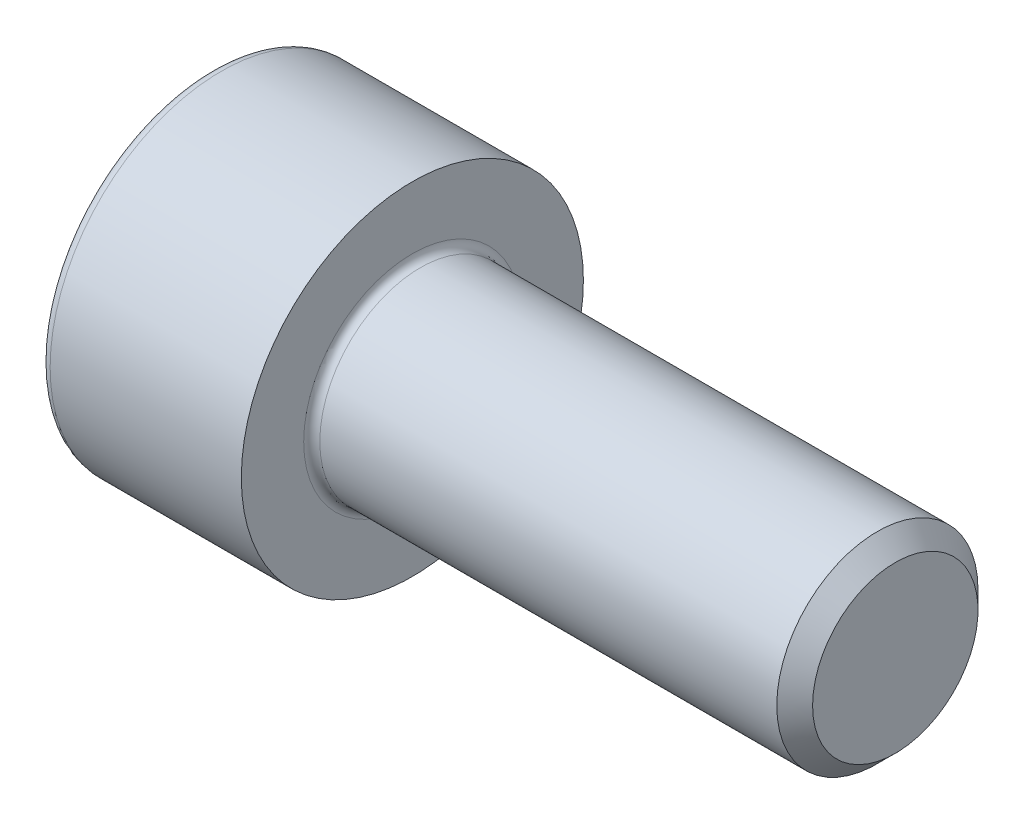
SolidWorks part; units mm, degrees
revolve "Base-Revolve" add sketch "BodySke" angle 360 about L6
sketch "BodySke" plane through (0, 0, 0) normal (0, 0, 1) x (1, 0, 0)
  line L0 (0, 0) -> (0, 4.25)
  line L1 (0, 4.25) -> (5, 4.25)
  line L2 (5, 4.25) -> (5, 2.5)
  line L3 (5, 2.5) -> (16.555, 2.5)
  line L4 (17, 2.055) -> (17, 0)
  line L5 (17, 0) -> (0, 0)
  line L6 (-31.75, 0) -> (127, 0) construction
  line L8 (17, 2.055) -> (16.555, 2.5)
  line L10 (17, -2.055) -> (16.555, -2.5) construction
  line L11 (5.8, 9.525) -> (5.8, 3.175) construction
  line L12 (5, 9.525) -> (5, 3.175) construction
  line L13 (-55, 9.525) -> (-55, 3.175) construction
fillet "Fillet2" radius 0.25 1 edges at (0, 0, 4.25)
ref_plane "Plane1" through (0, 0, 0) normal (0, 0, 1) x (1, 0, 0)
ref_plane "Plane2" through (0, 0, 0) normal (0, 1, 0) x (1, 0, 0)
ref_plane "Plane3" through (0, 0, 0) normal (1, 0, 0) x (0, 0, -1)
fillet "Fillet1" radius 0.2 1 edges at (5, 0, 2.5)
sketch "Sketch2" plane through (0, 0, 0) normal (0, 0, 1) x (1, 0, 0)
  line L0 (0, 2.042) -> (2.5, 2.042)
  line L1 (2.5, 2.042) -> (3.6789, 0)
  line L2 (-31.75, 0) -> (127, 0) construction
  line L3 (3.6789, 0) -> (0, 0)
  line L4 (0, 0) -> (0, 2.042)
  line L6 (0, 0) -> (47.625, 0) construction
revolve "Hex-PreBroach" cut sketch "Sketch2" angle 360 about L6
sketch "Sketch3" plane through (0, 0, 0) normal (-1, 0, 0) x (0, 0.5, 0.866)
  line L0 (1.1789, 2.042) -> (-1.1789, 2.042)
  line L1 (-1.1789, 2.042) -> (-2.3579, 0)
  line L2 (1.1789, 2.042) -> (2.3579, 0)
  line L3 (1.1789, -2.042) -> (2.3579, 0)
  line L4 (1.1789, -2.042) -> (-1.1789, -2.042)
  line L5 (-1.1789, -2.042) -> (-2.3579, 0)
extrude "Hex" cut sketch "Sketch3" against normal blind 2.5
sketch "ThdSchSke" plane through (0, 0, 0) normal (0, 0, 1) x (1, 0, 0)
  line L0 (7.4, -2.055) -> (7.0884, -2.5)
  line L1 (7.4, -2.055) -> (7.7116, -2.5)
  line L2 (7.7116, -2.5) -> (7.7116, -3.125)
  line L3 (-3.175, 0) -> (5.1513, 0) construction
  line L4 (0, 4) -> (0, -4) construction
  line L5 (7.7116, -3.125) -> (7.0884, -3.125)
  line L6 (7.0884, -3.125) -> (7.0884, -2.5)
revolve "ThreadSchematic" [suppressed] cut sketch "ThdSchSke" angle 360 about L3
pattern_linear "ThdSchPat" [suppressed]
equation "\"D2@Sketch3\" = \"Hex_size@Sketch3\" / 2"
equation "\"D1@Sketch3\" = \"Hex_size@Sketch3\" / 2"
equation "\"D1@Sketch2\" = \"Hex_size@Sketch3\" / 2"
equation "\"Thread_minor@ThreadCosmetic\"  =  \"Minor_dia@BodySke\""
equation "\"Depth@Sketch2\" =  \"Key_eng@Hex\""
equation "\"Thread_length@ThreadCosmetic\" = ((sgn( (\"Length@BodySke\" - \"Advance@BodySke\" * 3.0) - \"Thread_nom@BodySke\" )-1)*( (\"Length@BodySke\" - \"Advance@BodySke\" * 3.0) - \"Thread_nom@BodySke\" ))/-2+ \"Thread_no"
equation "\"Thread_minor@ThdSchSke\" = \"Minor_dia@BodySke\""
equation "\"Diameter@ThdSchSke\" = \"Diameter@BodySke\""
equation "\"Overcut@ThdSchSke\" = \"Diameter@BodySke\" * 1.25"
equation "\"Start@ThdSchSke\" = \"Head_ht@BodySke\" + \"Length@BodySke\" - \"Thread_length@ThreadCosmetic\"  '---Non-countersunk---"
equation "\"Num_threads@ThdSchPat\" = int( \"Thread_length@ThreadCosmetic\" / \"Advance@BodySke\" + 0.999 )  + 1"
equation "\"Advance@ThdSchPat\" = \"Thread_length@ThreadCosmetic\" /  (\"Num_threads@ThdSchPat\" - 1) 'relax it"
equation "\"Num_threads@ThdSchPat\" = \"Num_threads@ThdSchPat\" - sgn( \"Num_threads@ThdSchPat\" - 1) '---chamfered tips only---"
